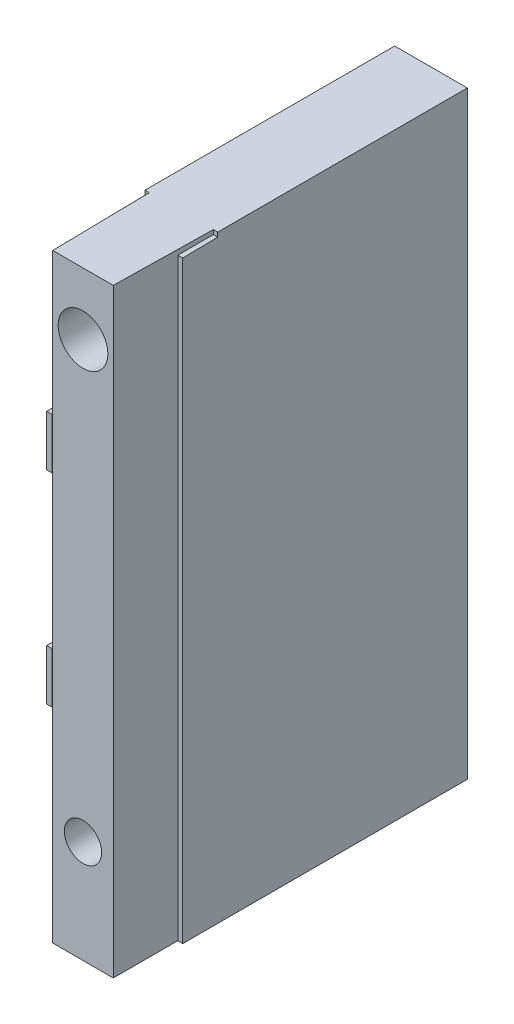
SolidWorks part; units mm, degrees
ref_plane "Plan de face" through (0, 0, 0) normal (0, 0, 1) x (1, 0, 0)
ref_plane "Plan de dessus" through (0, 0, 0) normal (0, 1, 0) x (1, 0, 0)
ref_plane "Plan de droite" through (0, 0, 0) normal (1, 0, 0) x (0, 0, -1)
imported_body "Importée1"
sketch "Esquisse1" plane through (0, 0, 0) normal (0, 0, 1) x (1, 0, 0)
  circle A0 centre (0, 30) radius 4
  dimension "D1" = 8
extrude "Extrusion1" cut sketch "Esquisse1" against normal through all
